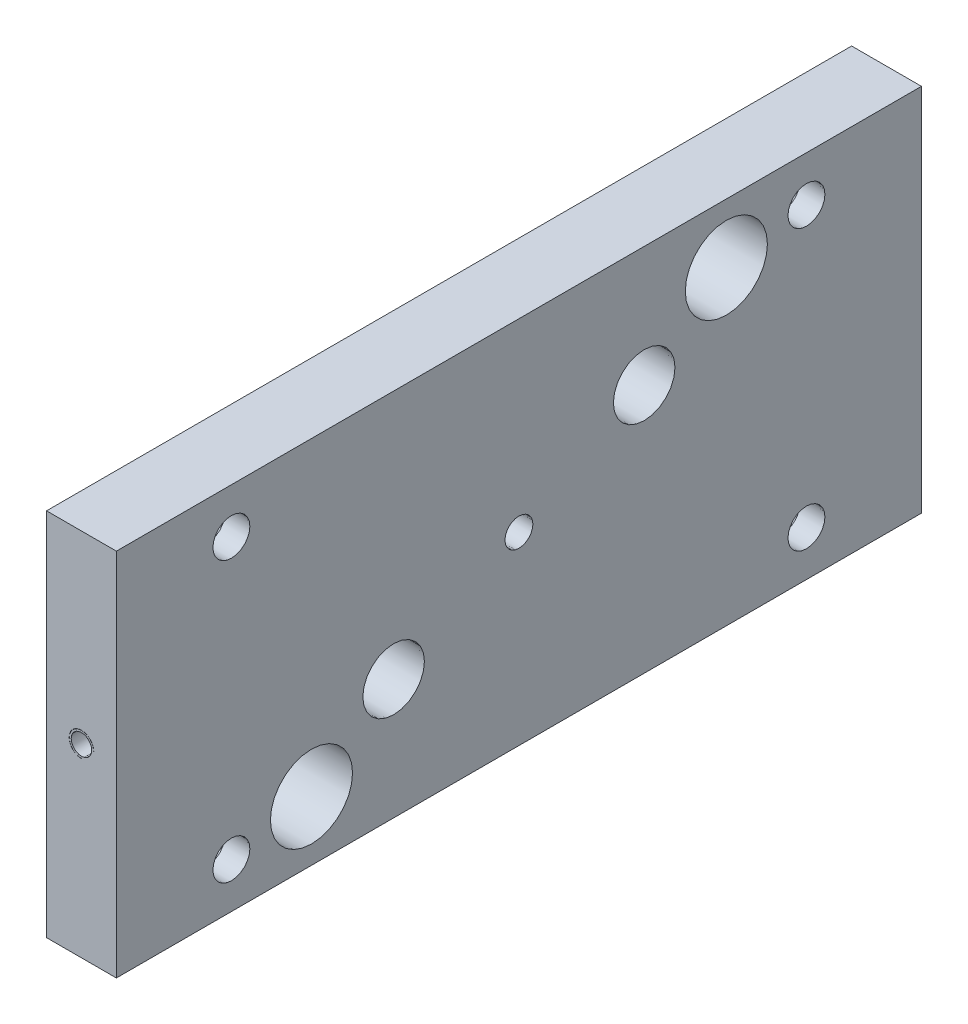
SolidWorks part; units mm, degrees
ref_plane "Plan de face" through (0, 0, 0) normal (0, 0, 1) x (1, 0, 0)
ref_plane "Plan de dessus" through (0, 0, 0) normal (0, 1, 0) x (1, 0, 0)
ref_plane "Plan de droite" through (0, 0, 0) normal (1, 0, 0) x (0, 0, -1)
imported_body "Importée1"
hole_wizard "Trou taraudé M81" positions "Esquisse3" profile "Esquisse4" tap size "M8" standard "ISO"
sketch "Esquisse3" plane through (-119, 0, 0) normal (-1, 0, 0) x (0, 0, 1)
  point P0 (0, 0)
sketch "Esquisse4" plane through (-119, 0, 0) normal (0, 1, 0) x (0, 0, 1)
  line L0 (0, 0) -> (0, 17)
  line L1 (0, 17) -> (3.4, 17)
  line L2 (3.4, 17) -> (3.4, 0)
  line L5 (3.4, 0) -> (0, 0)
  line L11 (0, -6.35) -> (0, 107.95) construction
  dimension "Diamètre du trou pour taraudage jusqu'au prochain" = 6.8
  dimension "Profondeur du trou pour taraudage jusqu'au prochain" = 17
